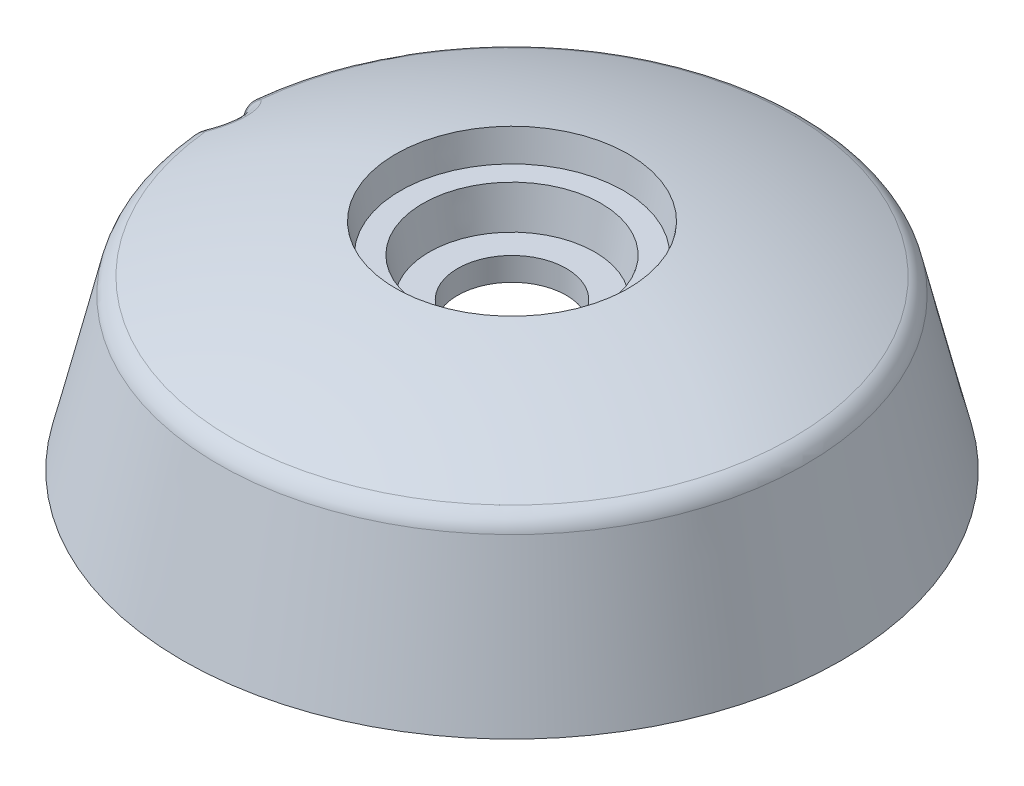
SolidWorks part; units mm, degrees
ref_plane "Front Plane" through (0, 0, 0) normal (0, 0, 1) x (1, 0, 0)
ref_plane "Top Plane" through (0, 0, 0) normal (0, 1, 0) x (1, 0, 0)
ref_plane "Right Plane" through (0, 0, 0) normal (1, 0, 0) x (0, 0, -1)
sketch "Sketch1" plane through (0, 0, 0) normal (0, 0, 1) x (1, 0, 0)
  line L0 (0, 0) -> (0, 36.4853) construction
  line L1 (-42.5, 0) -> (-37.5, 21)
  line L2 (-42.5, 0) -> (0, 0) construction
  line L3 (-15, 27.7675) -> (-14.3766, 24)
  line L4 (-14.3766, 24) -> (-11.5, 24)
  line L5 (-11.5, 24) -> (-10.6727, 19)
  line L6 (-10.6727, 19) -> (-7, 19)
  arc A0 (-37.5, 21) -> (-15, 27.7675) centre (0, -62.8906) cw
  dimension "D4" = 29
  dimension "D1" = 85
  dimension "D2" = 21
  dimension "D3" = 75
  dimension "D5" = 30
  dimension "D6" = 23
  dimension "D7" = 14
  dimension "D8" = 19
  dimension "D9" = 24
revolve "Revolve-Thin1" add sketch "Sketch1" angle 360 about L0
fillet "Fillet1" radius 3 1 edges at (0, 21, -37.5)
sketch "Sketch4" plane through (0, 0, 0) normal (0, 0, 1) x (1, 0, 0)
  line L0 (-37.8464, 19.5452) -> (-42.5, 0) construction
  line L1 (-36.2926, 30.3886) -> (-44.1143, -2.4628) construction
  line L2 (-39.1647, 5.3736) -> (-34.069, 26.7753)
  line L3 (-42.7779, 3.15) -> (-36.2926, 30.3886)
  line L4 (-42.7779, 3.15) -> (-60.6044, 7.3944) construction
  arc A0 (-42.7779, 3.15) -> (-39.1647, 5.3736) centre (-42.0831, 6.0685) ccw
  arc A1 (-36.2926, 30.3886) -> (-34.069, 26.7753) centre (-36.9874, 27.4702) cw
  dimension "D3" = 28
  dimension "D4" = 3
  dimension "D1" = 2
  dimension "D2" = 6
revolve "Cut-Revolve1" cut sketch "Sketch4" angle 360 about L1
fillet "Fillet2" radius 2 6 edges at (-41.7455, 3.1502, 0.608) (-39.1364, 13.7093, 2.7923) (-39.733, 11.2095, -2.7929) (-37.1656, 20.7367, 2.6605) (-36.8266, 21.1001, -2.5173) (-35.2286, 21.9783, -0.3185)
